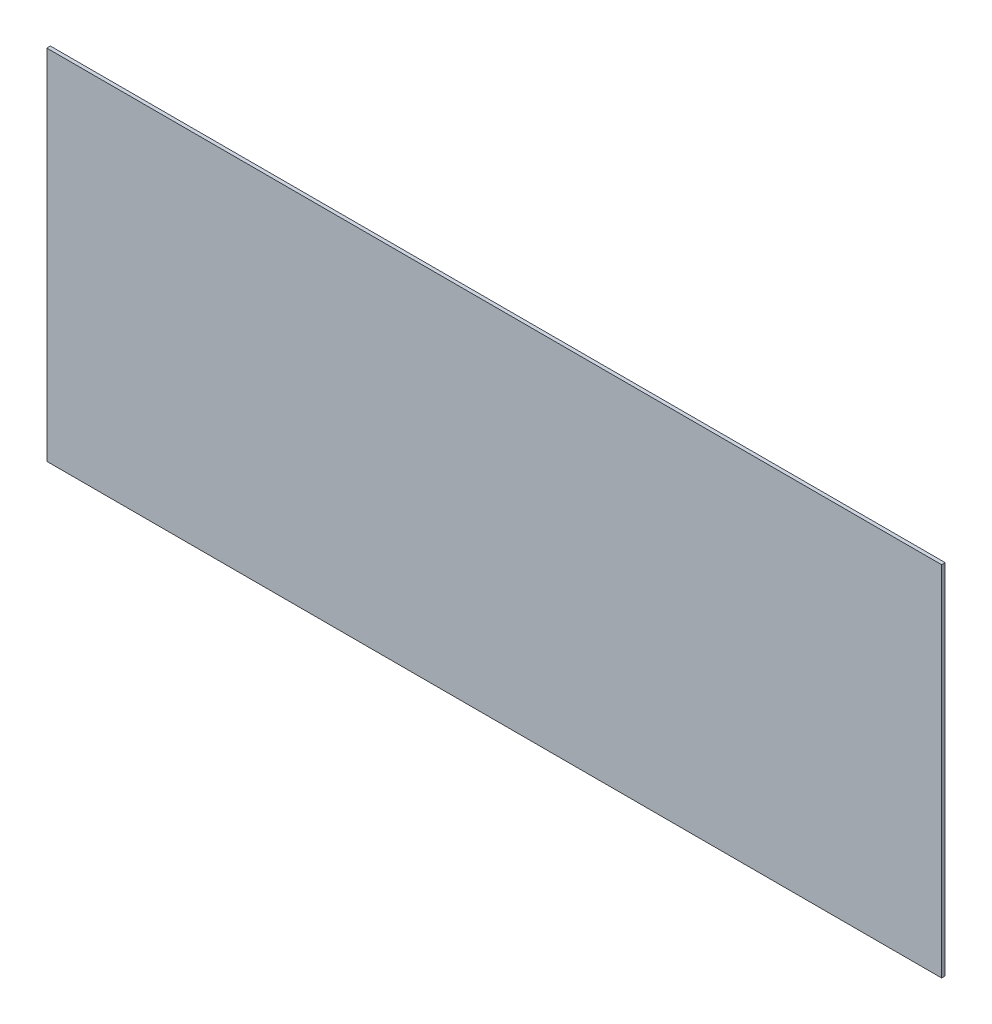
SolidWorks part; units mm, degrees
ref_plane "Front Plane" through (0, 0, 0) normal (0, 0, 1) x (1, 0, 0)
ref_plane "Top Plane" through (0, 0, 0) normal (0, 1, 0) x (1, 0, 0)
ref_plane "Right Plane" through (0, 0, 0) normal (1, 0, 0) x (0, 0, -1)
sketch "Sketch1" plane through (0, 0, 0) normal (0, 0, 1) x (1, 0, 0)
  line L1 (-125, -50) -> (125, -50)
  line L2 (-125, -50) -> (-125, 50)
  line L3 (-125, 50) -> (125, 50)
  line L4 (125, -50) -> (125, 50)
  line L5 (-125, -50) -> (125, 50) construction
  line L6 (-125, 50) -> (125, -50) construction
  point P0 (0, 0)
  dimension "D1" = 250
  dimension "D2" = 100
extrude "Boss-Extrude1" add sketch "Sketch1" along normal blind 1
